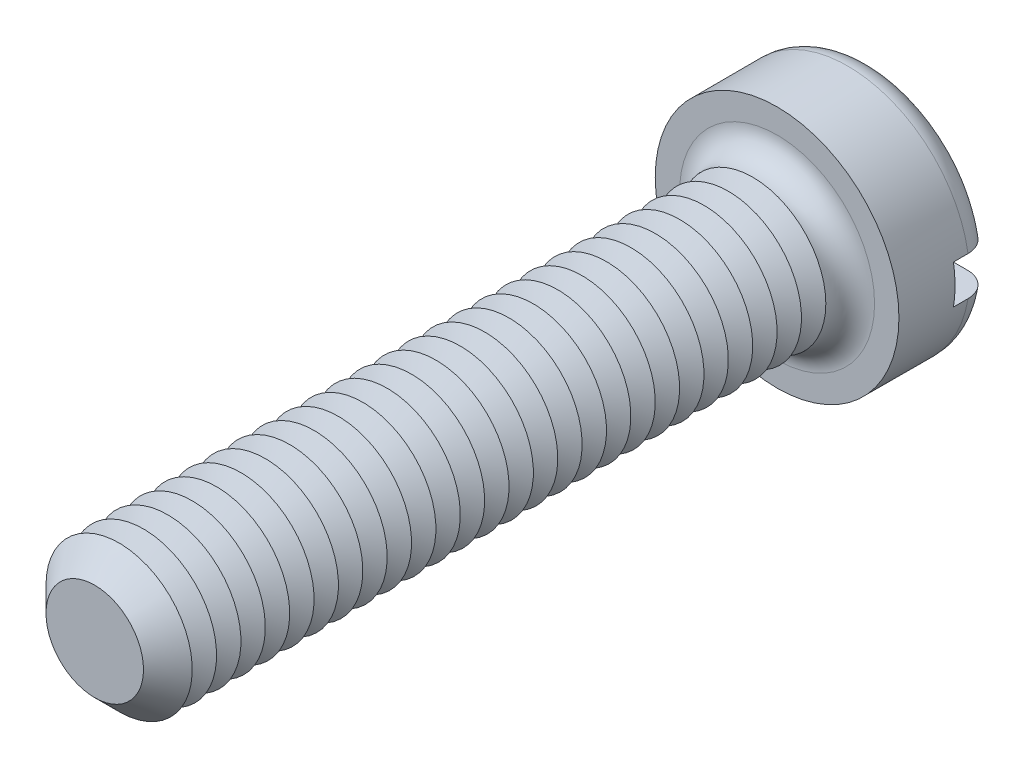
SolidWorks part; units mm, degrees
ref_plane "Front Plane" through (0, 0, 0) normal (0, 0, 1) x (1, 0, 0)
ref_plane "Top Plane" through (0, 0, 0) normal (0, 1, 0) x (1, 0, 0)
ref_plane "Right Plane" through (0, 0, 0) normal (1, 0, 0) x (0, 0, -1)
sketch "Sketch3" plane through (0, 0, 0) normal (0, 0, 1) x (1, 0, 0)
  circle A0 centre (0, 0) radius 5
  dimension "D1" = 10
extrude "Boss-Extrude2" add sketch "Sketch3" against normal blind 3.9
sketch "Sketch4" plane through (0, 0, 0) normal (0, 0, 1) x (1, 0, 0)
  circle A0 centre (0, 0) radius 3
  dimension "D1" = 6
extrude "Boss-Extrude3" add sketch "Sketch4" along normal blind 28
fillet "Fillet1" radius 1 2 edges at (5, 0, -3.9) (3, 0, 0)
chamfer "Chamfer1" distance 1 angle 45 1 edges at (3, 0, 28)
sketch "Sketch5" plane through (0, 0, 0) normal (1, 0, 0) x (0, 0, -1)
  line L0 (1.6944, 0) -> (-7.6738, 0) construction
sketch "Sketch6" plane through (0, 0, 0) normal (1, 0, 0) x (0, 0, -1)
  line L0 (-1, 3) -> (-1.5, 2.134)
  line L1 (-1.5, 2.134) -> (-2, 3)
  line L2 (-1, 3) -> (-27, 3) construction
  line L3 (-2, 3) -> (-1, 3)
  dimension "D1" = 1
revolve "Cut-Revolve1" cut sketch "Sketch6" angle 360 about L0
pattern_linear "LPattern1" count 26 spacing 1 along (0, 0, 1) of "Cut-Revolve1"
sketch "Sketch8" plane through (0, 0, -3.9) normal (0, 0, -1) x (-1, 0, 0)
  line L1 (5, -0.8) -> (-5, -0.8)
  line L2 (5, -0.8) -> (5, 0.8)
  line L3 (5, 0.8) -> (-5, 0.8)
  line L4 (-5, -0.8) -> (-5, 0.8)
  line L5 (5, -0.8) -> (-5, 0.8) construction
  line L6 (5, 0.8) -> (-5, -0.8) construction
  point P0 (0, 0)
  dimension "D1" = 10
  dimension "D2" = 1.6
extrude "Cut-Extrude1" cut sketch "Sketch8" against normal blind 1.6
